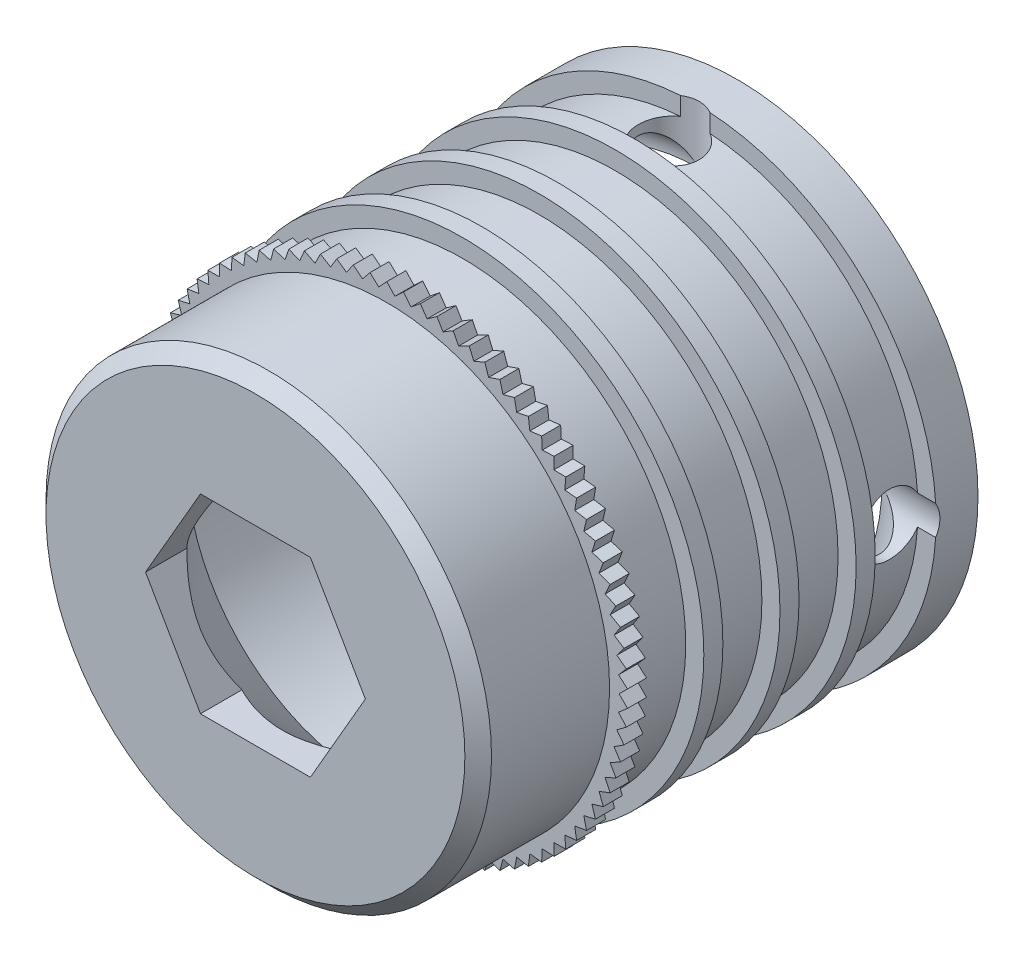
SolidWorks part; units mm, degrees
ref_plane "Front Plane" through (0, 0, 0) normal (0, 0, 1) x (1, 0, 0)
ref_plane "Top Plane" through (0, 0, 0) normal (0, 1, 0) x (1, 0, 0)
ref_plane "Right Plane" through (0, 0, 0) normal (1, 0, 0) x (0, 0, -1)
sketch "Sketch1" plane through (0, 0, 0) normal (0, 0, 1) x (1, 0, 0)
  circle A0 centre (0, 0) radius 6.325
  dimension "D1" = 12.65
extrude "Boss-Extrude1" add sketch "Sketch1" along normal blind 12.65
sketch "Sketch2" plane through (0, 0, 0) normal (0, 0, -1) x (-1, 0, 0)
  circle A0 centre (0, 0) radius 4.8
  dimension "D1" = 9.6
extrude "Cut-Extrude1" cut sketch "Sketch2" against normal blind 9.65
sketch "Sketch3" plane through (0, 0, 9.65) normal (0, 0, -1) x (-1, 0, 0)
  circle A0 centre (0, 0) radius 2.45
  dimension "D1" = 4.9
extrude "Cut-Extrude2" cut sketch "Sketch3" against normal through all
sketch "Sketch4" plane through (0, 0, 9.65) normal (0, 0, -1) x (-1, 0, 0)
  circle A0 centre (0, 0) radius 4.8
  circle A1 centre (0, 0) radius 4.8 construction
extrude "Cut-Extrude3" cut sketch "Sketch4" against normal through all draft 45
sketch "Sketch5" plane through (0, 0, 12.65) normal (0, 0, 1) x (1, 0, 0)
  line L0 (0, 0) -> (0, 6.325) construction
  line L1 (0, 0) -> (0.4412, 6.3096) construction
  line L2 (0, 6.325) -> (0.2129, 6.0967)
  line L3 (0.2129, 6.0967) -> (0.4412, 6.3096)
  circle A0 centre (0, 0) radius 6.325 construction
  arc A1 (0, 6.325) -> (0.4412, 6.3096) centre (0.2283, 6.5379) cw
  dimension "D1" = 4
extrude "Cut-Extrude4" cut sketch "Sketch5" against normal blind 4.2
pattern_circular "CirPattern1" count 90 over 360 about axis through (0, 0, 0) along (0, 0, 1) of "Cut-Extrude4"
chamfer "Chamfer1" distance 0.5 angle 45 1 edges at (-4.8, 0, 0)
sketch "Sketch6" plane through (0, 0, 0) normal (1, 0, 0) x (0, 0, -1)
  circle A0 centre (-1.8, 0) radius 0.8
  point P2 (-1, 0)
  dimension "D2" = 1.6
  dimension "D1" = 1
extrude "Cut-Extrude5" cut sketch "Sketch6" against normal through all both and the other way through all
pattern_circular "CirPattern2" count 2 over 90 about axis through (0, 0, 12.65) along (0, 0, -1) of "Cut-Extrude5"
sketch "Sketch7" plane through (0, 0, 0) normal (1, 0, 0) x (0, 0, -1)
  line L0 (0, -6.325) -> (0, 6.325) construction
  circle A0 centre (-1.8, 4.8) radius 0.8
  dimension "D1" = 1.6
  dimension "D2" = 1.8
  dimension "D3" = 4.8
revolve "Cut-Revolve1" cut sketch "Sketch7" angle 360 about axis through (0, 0, 12.65) along (0, 0, -1)
sketch "Sketch8" plane through (0, 0, 0) normal (1, 0, 0) x (0, 0, -1)
  line L0 (-2.6, 6.325) -> (-8.45, 6.325) construction
  line L1 (-2.7, 6.325) -> (-1.1, 6.325)
  line L2 (-2.7, 6.325) -> (-2.7, 5.85)
  line L3 (-2.7, 5.85) -> (-1.1, 5.85)
  line L4 (-1.1, 6.325) -> (-1.1, 5.85)
  line L6 (-3.2, 6.325) -> (-4.7, 6.325)
  line L7 (-3.2, 6.325) -> (-3.2, 5.85)
  line L8 (-3.2, 5.85) -> (-4.7, 5.85)
  line L9 (-4.7, 6.325) -> (-4.7, 5.85)
  line L10 (-5.2, 6.325) -> (-6.7, 6.325)
  line L11 (-5.2, 6.325) -> (-5.2, 5.85)
  line L12 (-5.2, 5.85) -> (-6.7, 5.85)
  line L13 (-6.7, 6.325) -> (-6.7, 5.85)
  line L19 (-2.6, 6.325) -> (-8.45, 6.325) construction
  line L24 (-8.7, 6.325) -> (-7.2, 6.325)
  line L25 (-8.7, 6.325) -> (-8.7, 5.85)
  line L26 (-8.7, 5.85) -> (-7.2, 5.85)
  line L27 (-7.2, 6.325) -> (-7.2, 5.85)
  line L28 (0, -6.325) -> (0, 6.325) construction
  line L29 (-9.2, 6.325) -> (-14.2, 6.325)
  line L30 (-9.2, 6.325) -> (-9.2, 5.85)
  line L31 (-9.2, 5.85) -> (-14.2, 5.85)
  line L32 (-14.2, 6.325) -> (-14.2, 5.85)
  line L33 (-14.2, 5.85) -> (-14.2, 0) construction
  line L35 (-14.2, 0) -> (-14.2, -5.85) construction
  line L36 (-9.2, 6.325) -> (-8.7, 6.325) construction
  line L37 (-7.2, 6.325) -> (-6.7, 6.325) construction
  line L38 (-5.2, 6.325) -> (-4.7, 6.325) construction
  line L39 (-3.2, 6.325) -> (-2.7, 6.325) construction
  dimension "D1" = 1.1
  dimension "D2" = 1.6
  dimension "D3" = 9.2
  dimension "D4" = 5
  dimension "D5" = 11.7
  dimension "D6" = 0.5
revolve "Cut-Revolve3" cut sketch "Sketch8" angle 360 about axis through (0, 0, 9.65) along (0, 0, -1)
sketch "Sketch9" plane through (0, 0, 12.65) normal (0, 0, 1) x (1, 0, 0)
  line L1 (1.4434, 2.5) -> (-1.4434, 2.5)
  line L2 (-1.4434, 2.5) -> (-2.8868, 0)
  line L3 (-2.8868, 0) -> (-1.4434, -2.5)
  line L4 (-1.4434, -2.5) -> (1.4434, -2.5)
  line L5 (1.4434, -2.5) -> (2.8868, 0)
  line L6 (2.8868, 0) -> (1.4434, 2.5)
  circle A0 centre (0, 0) radius 2.5 construction
  dimension "D1" = 5
extrude "Cut-Extrude6" cut sketch "Sketch9" against normal blind 10
sketch "Sketch10" plane through (0, 0, 12.65) normal (0, 0, 1) x (1, 0, 0)
  circle A0 centre (0, 0) radius 5.5
  dimension "D1" = 11
extrude "Cut-Extrude7" cut sketch "Sketch10" against normal through all draft 45 flip side to cut
